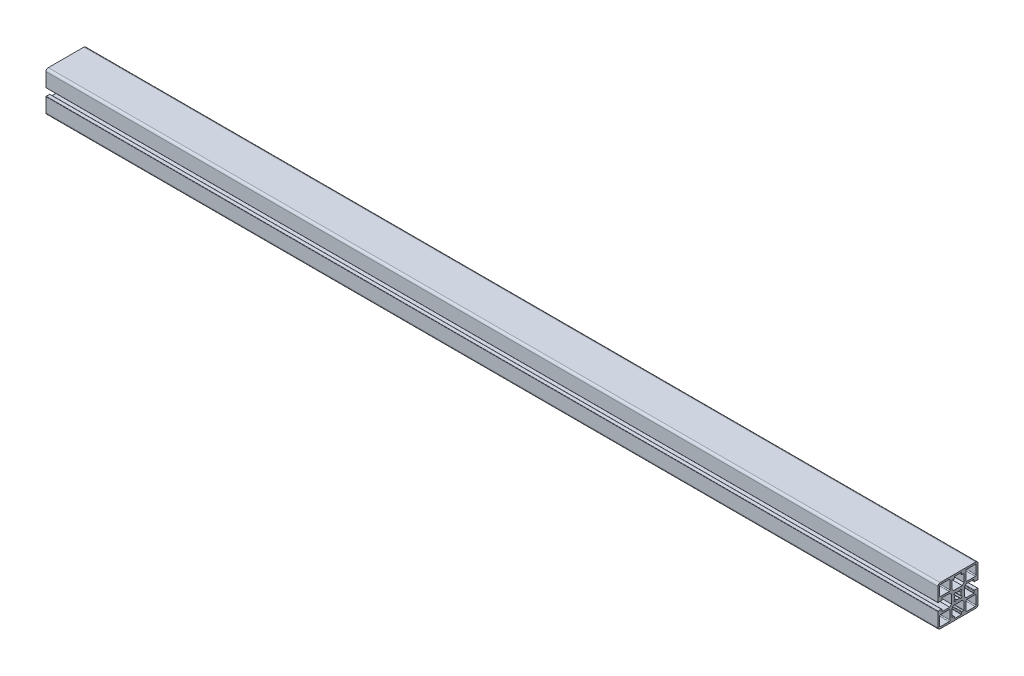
SolidWorks part; units mm, degrees
ref_plane "Front Plane" through (0, 0, 0) normal (0, 0, 1) x (1, 0, 0)
ref_plane "Top Plane" through (0, 0, 0) normal (0, 1, 0) x (1, 0, 0)
ref_plane "Right Plane" through (0, 0, 0) normal (1, 0, 0) x (0, 0, -1)
sketch3d "3DSketch1"
  line L0 (0, 0, 0) -> (1000, 0, 0)
  dimension "D1" = 1000
other "45-sarja 1.0173 45X45 L 2SS VASTA VAHV(1)"
ref_plane "Plane1" through (0, 0, 0) normal (1, 0, 0) x (0, 0, -1)
sketch "Model" plane through (0, 0, 0) normal (1, 0, 0) x (0, 0, -1)
  line L0 (6.5, 18) -> (4.6, 18)
  line L1 (4.1, 18.5) -> (4.1, 20.2)
  line L2 (-9.8, 20.5) -> (-19.5, 20.5)
  line L3 (3.8, 20.5) -> (-3.8, 20.5)
  line L4 (9.8, -20.5) -> (19.5, -20.5)
  line L5 (-4.1, 20.2) -> (-4.1, 18.5)
  line L6 (-4.6, 18) -> (-6.5, 18)
  line L7 (-6.8, 17.7) -> (-6.8, 9.2)
  line L8 (-6.8, 9.2) -> (-4.8, 7.2)
  line L9 (-4.8, 7.2) -> (4.8, 7.2)
  line L10 (4.8, 7.2) -> (6.8, 9.2)
  line L11 (6.8, 9.2) -> (6.8, 17.7)
  line L12 (20.5, 9.8) -> (20.5, 19.5)
  line L13 (19.5, 20.5) -> (9.8, 20.5)
  line L14 (8.8, 19.5) -> (8.8, 9.8)
  line L15 (9.8, 8.8) -> (19.5, 8.8)
  line L16 (-3.8, -20.5) -> (3.8, -20.5)
  line L17 (-20.5, 19.5) -> (-20.5, 9.8)
  line L18 (-19.5, 8.8) -> (-9.8, 8.8)
  line L19 (-8.8, 9.8) -> (-8.8, 19.5)
  line L20 (3.3633, 1.9491) -> (4.3841, 2.9698)
  line L21 (4.3841, 3.3941) -> (3.3941, 4.3841)
  line L22 (2.9698, 4.3841) -> (1.9491, 3.3633)
  line L23 (-1.9491, 3.3633) -> (-2.9698, 4.3841)
  line L24 (-3.3941, 4.3841) -> (-4.3841, 3.3941)
  line L25 (-4.3841, 2.9698) -> (-3.3633, 1.9491)
  line L26 (-3.3633, -1.9491) -> (-4.3841, -2.9698)
  line L27 (-4.3841, -3.3941) -> (-3.3941, -4.3841)
  line L28 (-2.9698, -4.3841) -> (-1.9491, -3.3633)
  line L29 (1.9491, -3.3633) -> (2.9698, -4.3841)
  line L30 (3.3941, -4.3841) -> (4.3841, -3.3941)
  line L31 (4.3841, -2.9698) -> (3.3633, -1.9491)
  line L32 (19.5, -8.8) -> (9.8, -8.8)
  line L33 (8.8, -9.8) -> (8.8, -19.5)
  line L34 (-19.5, -20.5) -> (-9.8, -20.5)
  line L35 (20.5, -19.5) -> (20.5, -9.8)
  line L37 (-8.8, -19.5) -> (-8.8, -9.8)
  line L38 (-9.8, -8.8) -> (-19.5, -8.8)
  line L39 (-20.5, -9.8) -> (-20.5, -19.5)
  line L40 (-4.6, -18) -> (-6.5, -18)
  line L41 (-4.1, -20.2) -> (-4.1, -18.5)
  line L43 (-22.5, 20) -> (-22.5, 4.4)
  line L44 (-18.5, -4.1) -> (-22.2, -4.1)
  line L45 (-18, -6.5) -> (-18, -4.6)
  line L46 (-9.2, -6.8) -> (-17.7, -6.8)
  line L47 (-7.2, -4.8) -> (-9.2, -6.8)
  line L48 (-7.2, 4.8) -> (-7.2, -4.8)
  line L49 (-9.2, 6.8) -> (-7.2, 4.8)
  line L50 (-17.7, 6.8) -> (-9.2, 6.8)
  line L51 (-18, 4.6) -> (-18, 6.5)
  line L52 (-22.2, 4.1) -> (-18.5, 4.1)
  line L54 (20, 22.5) -> (-20, 22.5)
  line L55 (22.5, 4.4) -> (22.5, 20)
  line L56 (18.5, 4.1) -> (22.2, 4.1)
  line L57 (18, 6.5) -> (18, 4.6)
  line L58 (9.2, 6.8) -> (17.7, 6.8)
  line L59 (7.2, 4.8) -> (9.2, 6.8)
  line L60 (7.2, -4.8) -> (7.2, 4.8)
  line L61 (9.2, -6.8) -> (7.2, -4.8)
  line L62 (17.7, -6.8) -> (9.2, -6.8)
  line L63 (18, -4.6) -> (18, -6.5)
  line L64 (22.2, -4.1) -> (18.5, -4.1)
  line L65 (22.5, -20) -> (22.5, -4.4)
  line L66 (-20, -22.5) -> (20, -22.5)
  line L67 (4.1, -18.5) -> (4.1, -20.2)
  line L68 (6.5, -18) -> (4.6, -18)
  line L69 (6.8, -9.2) -> (6.8, -17.7)
  line L70 (4.8, -7.2) -> (6.8, -9.2)
  line L71 (-4.8, -7.2) -> (4.8, -7.2)
  line L72 (-6.8, -9.2) -> (-4.8, -7.2)
  line L73 (-6.8, -17.7) -> (-6.8, -9.2)
  line L88 (-22.5, -4.4) -> (-22.5, -20)
  arc A0 (4.1, 18.5) -> (4.6, 18) centre (4.6, 18.5) ccw
  arc A1 (-4.1, -20.2) -> (-3.8, -20.5) centre (-3.8, -20.2) ccw
  arc A2 (4.1, -20.2) -> (3.8, -20.5) centre (3.8, -20.2) cw
  arc A3 (-4.6, 18) -> (-4.1, 18.5) centre (-4.6, 18.5) ccw
  arc A4 (-6.5, 18) -> (-6.8, 17.7) centre (-6.5, 17.7) ccw
  arc A5 (6.8, 17.7) -> (6.5, 18) centre (6.5, 17.7) ccw
  arc A6 (19.5, 8.8) -> (20.5, 9.8) centre (19.5, 9.8) ccw
  arc A7 (20.5, 19.5) -> (19.5, 20.5) centre (19.5, 19.5) ccw
  arc A8 (9.8, 20.5) -> (8.8, 19.5) centre (9.8, 19.5) ccw
  arc A9 (8.8, 9.8) -> (9.8, 8.8) centre (9.8, 9.8) ccw
  arc A10 (-8.8, 19.5) -> (-9.8, 20.5) centre (-9.8, 19.5) ccw
  arc A11 (-19.5, 20.5) -> (-20.5, 19.5) centre (-19.5, 19.5) ccw
  arc A12 (-20.5, 9.8) -> (-19.5, 8.8) centre (-19.5, 9.8) ccw
  arc A13 (-9.8, 8.8) -> (-8.8, 9.8) centre (-9.8, 9.8) ccw
  arc A14 (4.3841, 2.9698) -> (4.3841, 3.3941) centre (4.1719, 3.182) ccw
  arc A15 (3.3941, 4.3841) -> (2.9698, 4.3841) centre (3.182, 4.1719) ccw
  arc A16 (1.6059, 3.3056) -> (1.9491, 3.3633) centre (1.7369, 3.5754) ccw
  arc A17 (1.6059, 3.3056) -> (-1.6059, 3.3056) centre (0, 0) ccw
  arc A18 (-1.9491, 3.3633) -> (-1.6059, 3.3056) centre (-1.7369, 3.5754) ccw
  arc A19 (-2.9698, 4.3841) -> (-3.3941, 4.3841) centre (-3.182, 4.1719) ccw
  arc A20 (-4.3841, 3.3941) -> (-4.3841, 2.9698) centre (-4.1719, 3.182) ccw
  arc A21 (-3.3056, 1.6059) -> (-3.3633, 1.9491) centre (-3.5754, 1.7369) ccw
  arc A22 (-3.3056, 1.6059) -> (-3.3056, -1.6059) centre (0, 0) ccw
  arc A23 (-3.3633, -1.9491) -> (-3.3056, -1.6059) centre (-3.5754, -1.7369) ccw
  arc A24 (-4.3841, -2.9698) -> (-4.3841, -3.3941) centre (-4.1719, -3.182) ccw
  arc A25 (-3.3941, -4.3841) -> (-2.9698, -4.3841) centre (-3.182, -4.1719) ccw
  arc A26 (-1.6059, -3.3056) -> (-1.9491, -3.3633) centre (-1.7369, -3.5754) ccw
  arc A27 (-1.6059, -3.3056) -> (1.6059, -3.3056) centre (0, 0) ccw
  arc A28 (1.9491, -3.3633) -> (1.6059, -3.3056) centre (1.7369, -3.5754) ccw
  arc A29 (2.9698, -4.3841) -> (3.3941, -4.3841) centre (3.182, -4.1719) ccw
  arc A30 (4.3841, -3.3941) -> (4.3841, -2.9698) centre (4.1719, -3.182) ccw
  arc A31 (3.3056, -1.6059) -> (3.3633, -1.9491) centre (3.5754, -1.7369) ccw
  arc A32 (3.3056, -1.6059) -> (3.3056, 1.6059) centre (0, 0) ccw
  arc A33 (3.3633, 1.9491) -> (3.3056, 1.6059) centre (3.5754, 1.7369) ccw
  arc A34 (20.5, -9.8) -> (19.5, -8.8) centre (19.5, -9.8) ccw
  arc A35 (9.8, -8.8) -> (8.8, -9.8) centre (9.8, -9.8) ccw
  arc A36 (8.8, -19.5) -> (9.8, -20.5) centre (9.8, -19.5) ccw
  arc A37 (19.5, -20.5) -> (20.5, -19.5) centre (19.5, -19.5) ccw
  arc A38 (-20.5, -19.5) -> (-19.5, -20.5) centre (-19.5, -19.5) ccw
  arc A39 (-9.8, -20.5) -> (-8.8, -19.5) centre (-9.8, -19.5) ccw
  arc A40 (-8.8, -9.8) -> (-9.8, -8.8) centre (-9.8, -9.8) ccw
  arc A41 (-19.5, -8.8) -> (-20.5, -9.8) centre (-19.5, -9.8) ccw
  arc A42 (-4.1, -18.5) -> (-4.6, -18) centre (-4.6, -18.5) ccw
  arc A44 (-22.5, -20) -> (-20, -22.5) centre (-20, -20) ccw
  arc A46 (-18, -4.6) -> (-18.5, -4.1) centre (-18.5, -4.6) ccw
  arc A47 (-18, -6.5) -> (-17.7, -6.8) centre (-17.7, -6.5) ccw
  arc A48 (-17.7, 6.8) -> (-18, 6.5) centre (-17.7, 6.5) ccw
  arc A49 (-18.5, 4.1) -> (-18, 4.6) centre (-18.5, 4.6) ccw
  arc A51 (-20, 22.5) -> (-22.5, 20) centre (-20, 20) ccw
  arc A52 (22.5, 20) -> (20, 22.5) centre (20, 20) ccw
  arc A53 (22.2, 4.1) -> (22.5, 4.4) centre (22.2, 4.4) ccw
  arc A54 (18, 4.6) -> (18.5, 4.1) centre (18.5, 4.6) ccw
  arc A55 (18, 6.5) -> (17.7, 6.8) centre (17.7, 6.5) ccw
  arc A56 (17.7, -6.8) -> (18, -6.5) centre (17.7, -6.5) ccw
  arc A57 (18.5, -4.1) -> (18, -4.6) centre (18.5, -4.6) ccw
  arc A58 (22.5, -4.4) -> (22.2, -4.1) centre (22.2, -4.4) ccw
  arc A59 (20, -22.5) -> (22.5, -20) centre (20, -20) ccw
  arc A61 (4.6, -18) -> (4.1, -18.5) centre (4.6, -18.5) ccw
  arc A62 (6.5, -18) -> (6.8, -17.7) centre (6.5, -17.7) ccw
  arc A63 (-6.8, -17.7) -> (-6.5, -18) centre (-6.5, -17.7) ccw
  arc A67 (-22.2, -4.1) -> (-22.5, -4.4) centre (-22.2, -4.4) ccw
  arc A69 (-22.2, 4.1) -> (-22.5, 4.4) centre (-22.2, 4.4) cw
  arc A70 (4.1, 20.2) -> (3.8, 20.5) centre (3.8, 20.2) ccw
  arc A71 (-4.1, 20.2) -> (-3.8, 20.5) centre (-3.8, 20.2) cw
  point P8 (-4.1, -20.5)
  point P126 (-22.5, -4.1)
  point P181 (4.1, 20.5)
  point P199 (0, 0)
  point P200 (0, 22.5)
  point P201 (-22.5, 0)
  point P202 (22.5, 0)
  point P203 (0, -22.5)
  point P204 (-22.5, 22.5)
  point P205 (22.5, 22.5)
  point P206 (22.5, -22.5)
  point P207 (-22.5, -22.5)
  point P209 (0, 0)
  point P211 (-21, 0)
  dimension "D1" = 0.3
  dimension "D2" = 0.3
